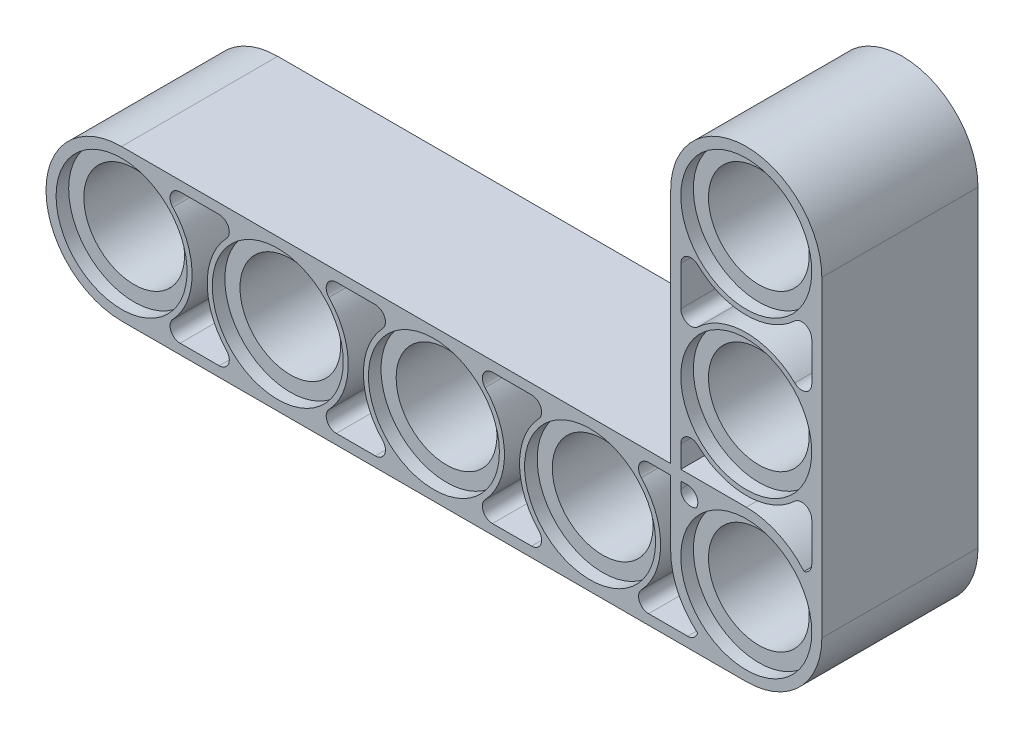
SolidWorks part; units mm, degrees
other "<Three_Straight>-<Mirror3>"
other "<Five_Straight>-<Mirror3>"
other "<L_Three_Five_90degrees-extra>-<Combine1>"
ref_plane "Front Plane" through (0, 0, 0) normal (0, 0, 1) x (1, 0, 0)
ref_plane "Top Plane" through (0, 0, 0) normal (0, 1, 0) x (1, 0, 0)
ref_plane "Right Plane" through (0, 0, 0) normal (1, 0, 0) x (0, 0, -1)
ref_plane "Front Plane-Five_Straight" through (0, 0, 0) normal (0, 0, 1) x (1, 0, 0)
ref_plane "Top Plane-Five_Straight" through (0, 0, 0) normal (0, 1, 0) x (1, 0, 0)
ref_plane "Right Plane-Five_Straight" through (0, 0, 0) normal (1, 0, 0) x (0, 0, -1)
ref_plane "Plane2-Five_Straight" through (11.684, 0, 0) normal (1, 0, 0) x (0, 0, -1)
ref_plane "Plane1-Five_Straight" through (-7.874, 0, 0) normal (1, 0, 0) x (0, 0, -1)
ref_plane "Plane3-Five_Straight" through (0, 0, 3.81) normal (0, 0, 1) x (1, 0, 0)
ref_plane "Plane4-Five_Straight" through (-27.432, 0, 0) normal (-1, 0, 0) x (0, 0, 1)
inserted part "Five_Straight"
ref_plane "Front Plane-Three_Straight" through (0.5893, 14.2774, -10.1833) normal (0, 0, 1) x (1, 0, 0)
ref_plane "Top Plane-Three_Straight" through (0.5893, 14.2774, -10.1833) normal (0, 1, 0) x (1, 0, 0)
ref_plane "Right Plane-Three_Straight" through (0.5893, 14.2774, -10.1833) normal (1, 0, 0) x (0, 0, -1)
ref_plane "Plane2-Three_Straight" through (12.2733, 14.2774, -10.1833) normal (1, 0, 0) x (0, 0, -1)
ref_plane "Plane1-Three_Straight" through (0.5893, 14.2774, -10.1833) normal (1, 0, 0) x (0, 0, -1)
ref_plane "Plane3-Three_Straight" through (0.5893, 14.2774, -6.3733) normal (0, 0, 1) x (1, 0, 0)
ref_plane "Plane4-Three_Straight" through (-11.0947, 14.2774, -10.1833) normal (-1, 0, 0) x (0, 0, 1)
inserted part "Three_Straight"
move or copy body "Body-Move/Copy1" bodies to move or copy 102 placed by mates yes
other "Angle1" parameters "D1"=90
combine bodies "Combine1" operation type add bodies to combine 101 103
inserted part "L_Three_Five_90degrees-extra"
move or copy body "Body-Move/Copy3" placed by mates yes
other "Distance1" parameters "D1"=0.254
combine bodies "Combine2" operation type add bodies to combine 104 105
